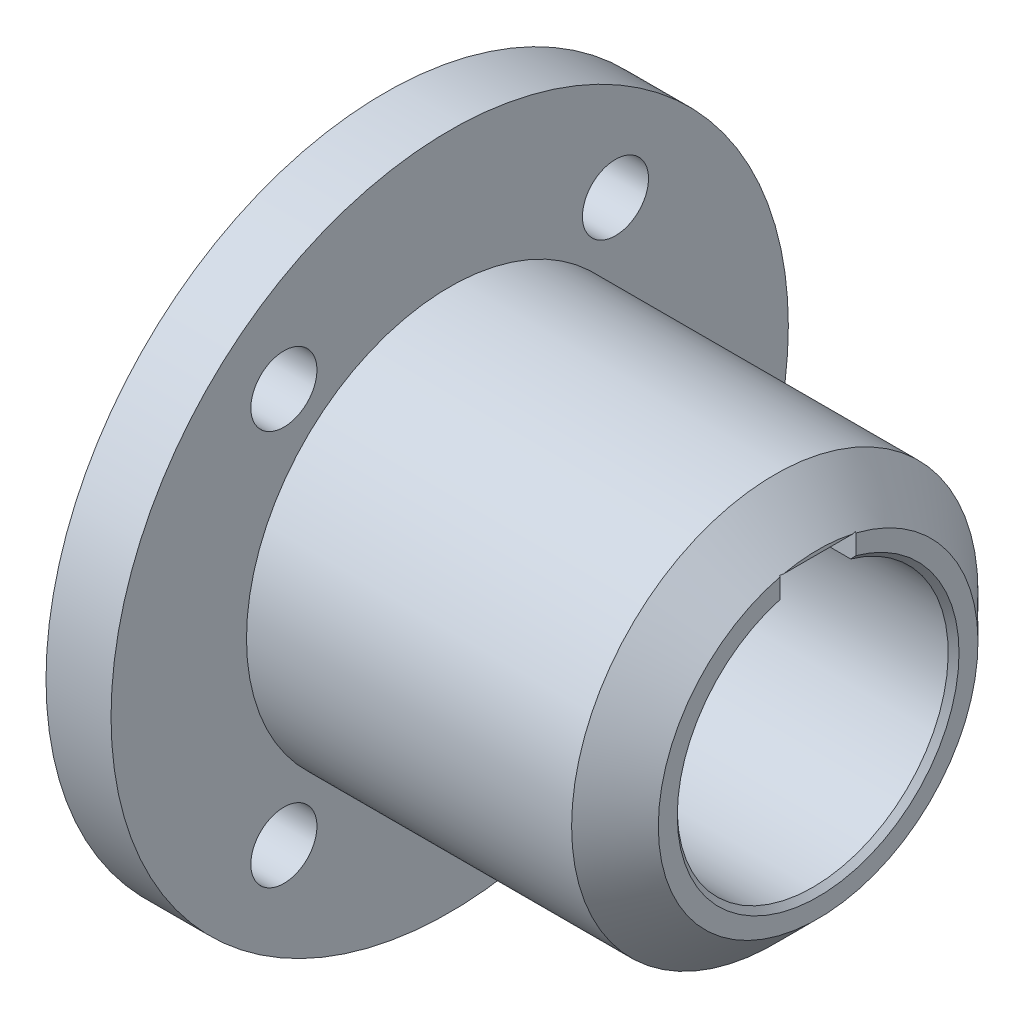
SolidWorks part; units mm, degrees
ref_plane "Face" through (0, 0, 0) normal (0, 0, 1) x (1, 0, 0)
ref_plane "Dessus" through (0, 0, 0) normal (0, 1, 0) x (1, 0, 0)
ref_plane "Droite" through (0, 0, 0) normal (1, 0, 0) x (0, 0, -1)
sketch "Esquisse1" plane through (0, 0, 0) normal (0, 0, 1) x (1, 0, 0)
  line L0 (0, 0) -> (78.4224, 0) construction
  line L1 (0, 62.5) -> (12, 62.5)
  line L2 (12, 62.5) -> (12, 37.5)
  line L3 (12, 37.5) -> (72, 37.5)
  line L4 (80, 29.5) -> (80, 26)
  line L5 (79, 25) -> (18, 25)
  line L6 (18, 25) -> (18, 31)
  line L7 (18, 31) -> (3, 31)
  line L8 (3, 31) -> (3, 34.925)
  line L9 (3, 34.925) -> (0, 34.925)
  line L10 (0, 34.925) -> (0, 62.5)
  line L11 (72, 37.5) -> (80, 29.5)
  line L12 (80, 26) -> (79, 25)
  point P7 (80, 37.5)
  point P8 (80, 25)
  dimension "D1" = 50
  dimension "D2" = 62
  dimension "D3" = 69.85
  dimension "D4" = 125
  dimension "D5" = 80
  dimension "D6" = 68
  dimension "D7" = 3
  dimension "D8" = 18
  dimension "D9" = 8
  dimension "D10" = 45
  dimension "D11" = 1
  dimension "D12" = 45
  dimension "D13" = 75
revolve "Révolution1" add sketch "Esquisse1" angle 360 about L0
sketch "Esquisse2" plane through (80, 0, 0) normal (1, 0, 0) x (0, 0, -1)
  line L0 (0, 0) -> (0, 68.7838) construction
  line L1 (-7, 28.8) -> (7, 28.8)
  line L2 (-7, 28.8) -> (-7, 16.9266)
  line L3 (-7, 16.9266) -> (7, 16.9266)
  line L4 (7, 28.8) -> (7, 16.9266)
  circle A0 centre (0, 0) radius 25 construction
  dimension "D1" = 14
  dimension "D2" = 7
  dimension "D3" = 28.8
extrude "Enlèv. mat.-Extru.1" cut sketch "Esquisse2" against normal through all
sketch "Esquisse3" plane through (0, 0, 0) normal (-1, 0, 0) x (0, 0, 1)
  line L0 (0, 0) -> (45.7888, 54.569) construction
  line L1 (0, 0) -> (0, 77.5865) construction
  line L2 (0, 0) -> (51.9362, -61.8951) construction
  circle A0 centre (0, 0) radius 47.6 construction
  circle A1 centre (30.5967, 36.4637) radius 6.1
  circle A2 centre (30.5967, -36.4637) radius 6.1
  dimension "D3" = 95.2
  dimension "D4" = 12.2
  dimension "D5" = 12.2
  dimension "D1" = 40
  dimension "D2" = 140
extrude "Enlèv. mat.-Extru.2" cut sketch "Esquisse3" against normal through all
ref_plane "Plan1" through (0, 0, 0) normal (0, 0, 1) x (1, 0, 0)
mirror "Symétrie1" about plane through (0, 0, 0) normal (0, 0, 1) of "Enlèv. mat.-Extru.2"
